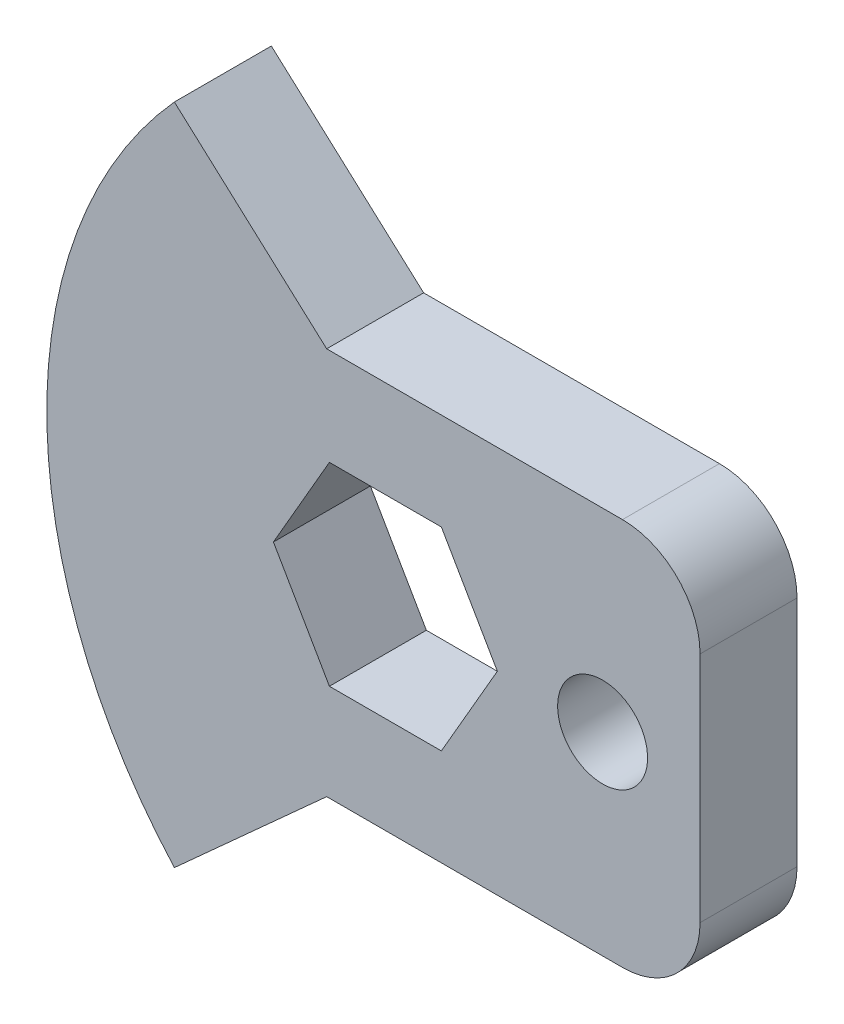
SolidWorks part; units mm, degrees
ref_plane "Front Plane" through (0, 0, 0) normal (0, 0, 1) x (1, 0, 0)
ref_plane "Top Plane" through (0, 0, 0) normal (0, 1, 0) x (1, 0, 0)
ref_plane "Right Plane" through (0, 0, 0) normal (1, 0, 0) x (0, 0, -1)
sketch "Sketch1" plane through (0, 0, 0) normal (0, 0, -1) x (-1, 0, 0)
  line L1 (0, 0) -> (17.145, 0)
  line L2 (0, 0) -> (0, 12.7)
  line L3 (0, 12.7) -> (17.145, 12.7)
  line L4 (17.145, 0) -> (17.145, 12.7)
  line L5 (13.97, 6.35) -> (12.1369, 9.525)
  line L6 (12.1369, 9.525) -> (8.4707, 9.525)
  line L7 (8.4707, 9.525) -> (6.6377, 6.35)
  line L8 (6.6377, 6.35) -> (8.4707, 3.175)
  line L9 (8.4707, 3.175) -> (12.1369, 3.175)
  line L10 (12.1369, 3.175) -> (13.97, 6.35)
  circle A1 centre (10.3038, 6.35) radius 3.175 construction
  point P8 (0, 6.35)
  dimension "D1" = 3.175
  dimension "D4" = 6.35
  dimension "D3" = 17.145
  dimension "D5" = 12.7
  dimension "D7" = 7.3323
extrude "Boss-Extrude1" add sketch "Sketch1" along normal blind 3.175
hole_wizard "#4 Clearance Hole1" positions "Sketch3" profile "Sketch2" hole size "#4" standard "ANSI Inch"
sketch "Sketch3" plane through (0, 0, -3.175) normal (0, 0, -1) x (-1, 0, 0)
  line L0 (0, 12.7) -> (0, 0) construction
  point P5 (3.1918, 6.35)
  dimension "D1" = 7.112
  dimension "D2" = 3.1918
sketch "Sketch2" plane through (-3.1918, 6.35, -3.175) normal (1, 0, 0) x (0, 1, 0)
  line L0 (0, 0) -> (0, 3.175)
  line L1 (0, 3.175) -> (1.4732, 3.175)
  line L2 (1.4732, 3.175) -> (1.4732, 0)
  line L5 (1.4732, 0) -> (0, 0)
  line L11 (0, -6.35) -> (0, 107.95) construction
  dimension "Thru Hole Dia." = 2.9464
  dimension "Thru Hole Depth" = 3.175
fillet "Fillet1" radius 2.54 4 edges at (-17.145, 0, -1.5875) (0, 0, -1.5875) (-17.145, 12.7, -1.5875) (0, 12.7, -1.5875)
sketch "Sketch4" plane through (0, 0, 0) normal (0, 0, 1) x (1, 0, 0)
  line L0 (-11.5593, 12.0974) -> (-11.5593, 0.6026) construction
  line L1 (-11.5593, 12.0974) -> (-17.2134, 17.2058)
  line L2 (-17.2134, -4.5058) -> (-11.5593, 0.6026)
  line L3 (-11.5593, 12.0974) -> (-15.9376, 9.2069)
  line L4 (-15.9376, 3.4931) -> (-11.5593, 0.6026)
  line L5 (-14.9649, 8.328) -> (-15.9376, 9.2069) construction
  line L6 (-15.9376, 3.4931) -> (-14.9649, 4.372) construction
  arc A0 (-15.9376, 9.2069) -> (-15.9376, 3.4931) centre (-5.198, 6.35) ccw
  arc A1 (-17.2134, 17.2058) -> (-17.2134, -4.5058) centre (-5.198, 6.35) ccw
  point P2 (-11.5593, 6.35)
  dimension "D2" = 7.62
  dimension "D1" = 5.08
extrude "Boss-Extrude2" add sketch "Sketch4" against normal blind 3.175
